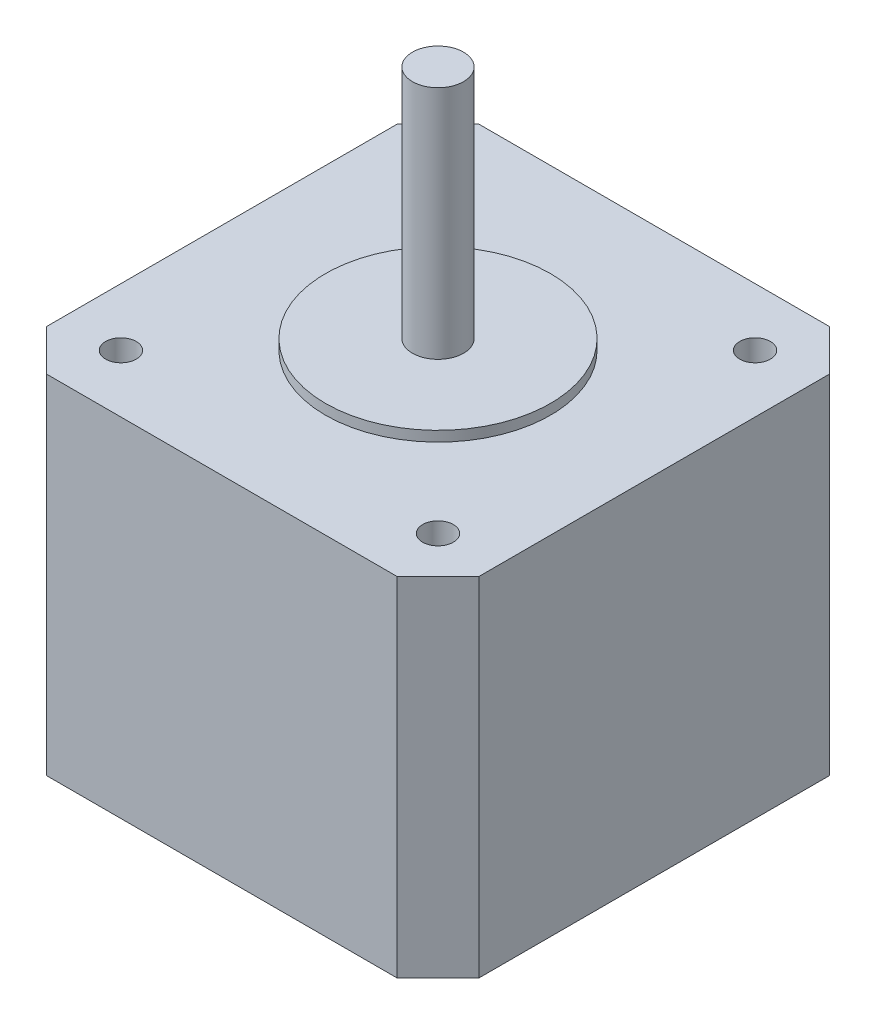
SolidWorks part; units mm, degrees
ref_plane "Front Plane" through (0, 0, 0) normal (0, 0, 1) x (1, 0, 0)
ref_plane "Top Plane" through (0, 0, 0) normal (0, 1, 0) x (1, 0, 0)
ref_plane "Right Plane" through (0, 0, 0) normal (1, 0, 0) x (0, 0, -1)
sketch "Sketch1" plane through (0, 0, 0) normal (0, 1, 0) x (1, 0, 0)
  line L1 (0, 0) -> (42.3, 0)
  line L2 (0, 0) -> (0, 42.3)
  line L3 (0, 42.3) -> (42.3, 42.3)
  line L4 (42.3, 0) -> (42.3, 42.3)
  dimension "D1" = 42.3
  dimension "D2" = 42.3
extrude "Boss-Extrude1" add sketch "Sketch1" along normal blind 34
sketch "Sketch2" plane through (0, 34, 0) normal (0, 1, 0) x (1, 0, 0)
  line L0 (21.15, 42.3) -> (21.15, 0) construction
  line L1 (42.3, 42.3) -> (0, 42.3) construction
  line L2 (0, 0) -> (42.3, 0) construction
  line L3 (36.65, 21.15) -> (5.65, 21.15) construction
  line L4 (5.65, 36.65) -> (5.65, 5.65) construction
  line L5 (36.65, 5.65) -> (36.65, 36.65) construction
  circle A0 centre (36.65, 36.65) radius 1.5
  circle A1 centre (5.65, 36.65) radius 1.5
  circle A2 centre (5.65, 5.65) radius 1.5
  circle A3 centre (36.65, 5.65) radius 1.5
  point P9 (21.15, 21.15)
  point P12 (5.65, 21.15)
  point P15 (36.65, 21.15)
  dimension "D3" = 3
  dimension "D4" = 3
  dimension "D5" = 3
  dimension "D6" = 3
  dimension "D1" = 31
  dimension "D2" = 31
extrude "Cut-Extrude1" cut sketch "Sketch2" against normal blind 4.5
sketch "Sketch3" plane through (0, 34, 0) normal (0, 1, 0) x (1, 0, 0)
  line L0 (21.15, 42.3) -> (21.15, 0) construction
  line L1 (42.3, 42.3) -> (0, 42.3) construction
  line L2 (0, 0) -> (42.3, 0) construction
  circle A0 centre (21.15, 21.15) radius 11
  dimension "D1" = 22
fillet "Chamfer1" radius 4 4 edges at (0, 17, -42.3) (0, 17, 0) (42.3, 17, -42.3) (42.3, 17, 0)
extrude "Boss-Extrude3" add sketch "Sketch3" along normal blind 1
sketch "Sketch5" plane through (0, 35, 0) normal (0, 1, 0) x (1, 0, 0)
  circle A0 centre (21.15, 21.15) radius 2.5
  dimension "D1" = 5
extrude "Boss-Extrude4" add sketch "Sketch5" along normal blind 23
